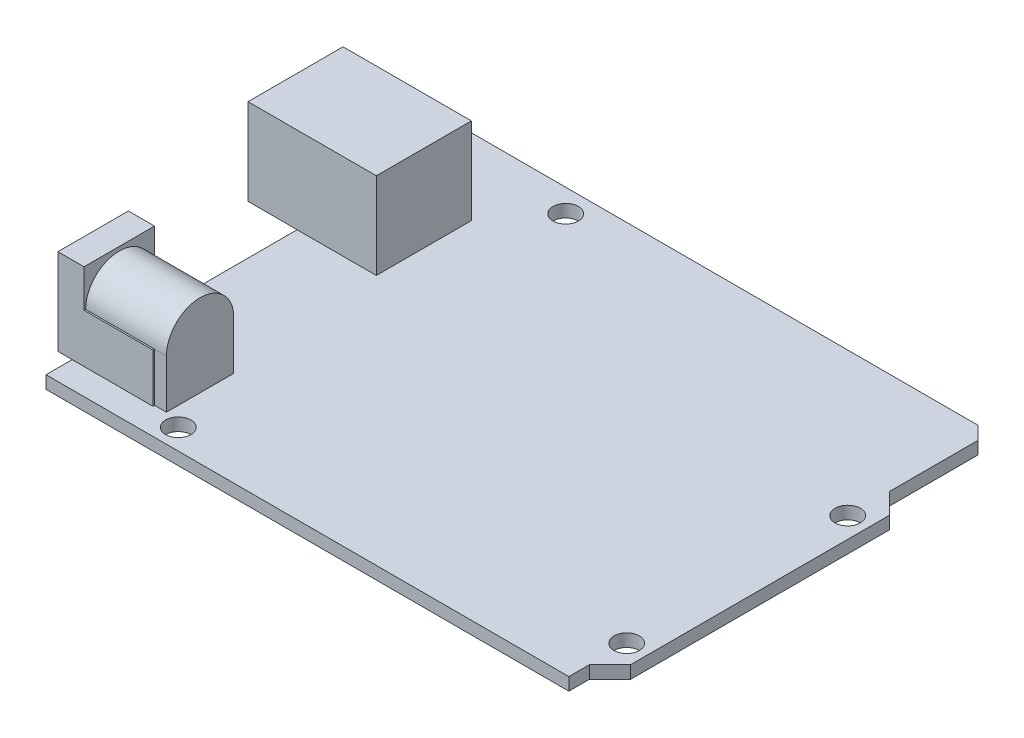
SolidWorks part; units mm, degrees
ref_plane "前基準面" through (0, 0, 0) normal (0, 0, 1) x (1, 0, 0)
ref_plane "上基準面" through (0, 0, 0) normal (0, 1, 0) x (1, 0, 0)
ref_plane "右基準面" through (0, 0, 0) normal (1, 0, 0) x (0, 0, -1)
sketch "草圖1" plane through (0, 0, 0) normal (0, 1, 0) x (1, 0, 0)
  line L0 (30.05, 26.65) -> (31.7, 25)
  line L1 (-34.3, 26.65) -> (30.05, 26.65)
  line L2 (-34.3, 26.65) -> (-34.3, -26.65)
  line L3 (-34.3, -26.65) -> (31.7, -26.65)
  line L4 (34.3, 11.25) -> (34.3, -21.45)
  line L5 (-34.3, 26.65) -> (34.3, -26.65) construction
  line L6 (-34.3, -26.65) -> (34.3, 26.65) construction
  line L7 (31.7, 25) -> (31.7, 13.85)
  line L8 (31.7, 13.85) -> (34.3, 11.25)
  line L9 (34.3, -21.45) -> (31.7, -24.05)
  line L10 (31.7, -24.05) -> (31.7, -26.65)
  line L11 (31.7, -26.65) -> (34.3, -26.65) construction
  line L12 (34.3, -26.65) -> (34.3, -21.45) construction
  line L13 (30.05, 26.65) -> (34.3, 26.65) construction
  line L14 (34.3, 26.65) -> (34.3, 11.25) construction
  line L15 (31.7, 13.85) -> (31.7, -24.05) construction
  circle A0 centre (-19.1, 23.75) radius 1.6
  circle A1 centre (-20.2, -24.05) radius 1.6
  circle A2 centre (31.7, 8.55) radius 1.6
  circle A3 centre (31.7, -19.35) radius 1.6
  point P0 (0, 0)
  point P22 (-20.2, -25.65)
  point P23 (-19.1, 25.35)
  point P26 (34.3, -5.1)
  dimension "D5" = 3.2
  dimension "D1" = 53.3
  dimension "D2" = 68.6
  dimension "D3" = 1.1
  dimension "D4" = 50.8
  dimension "D6" = 15.2
  dimension "D7" = 4.7
  dimension "D8" = 27.9
  dimension "D9" = 1.25
  dimension "D12" = 34.3
  dimension "D13" = 2.6
  dimension "D14" = 1
  dimension "D15" = 45
  dimension "D16" = 12.8
  dimension "D17" = 45
extrude "填料-伸長1" add sketch "草圖1" along normal blind 1.6
sketch "草圖3" plane through (0, 1.6, 0) normal (0, 1, 0) x (1, 0, 0)
  line L0 (30.05, 26.65) -> (-34.3, 26.65) construction
  line L1 (-40.5, 17.05) -> (-24.3, 17.05)
  line L2 (-40.5, 17.05) -> (-40.5, 5.05)
  line L3 (-40.5, 5.05) -> (-24.3, 5.05)
  line L4 (-24.3, 17.05) -> (-24.3, 5.05)
  line L5 (34.3, -21.45) -> (34.3, 11.25) construction
  dimension "D1" = 12
  dimension "D2" = 9.6
  dimension "D3" = 74.8
  dimension "D4" = 16.2
extrude "填料-伸長2" add sketch "草圖3" along normal blind 10.9
sketch "草圖4" plane through (0, 1.6, 0) normal (0, 1, 0) x (1, 0, 0)
  line L0 (-34.3, -26.65) -> (31.7, -26.65) construction
  line L1 (-36.1, -14.45) -> (-22.6, -14.45)
  line L2 (-36.1, -14.45) -> (-36.1, -23.35)
  line L3 (-36.1, -23.35) -> (-22.6, -23.35)
  line L4 (-22.6, -14.45) -> (-22.6, -23.35)
  dimension "D1" = 1.8
  dimension "D2" = 13.5
  dimension "D3" = 3.3
  dimension "D4" = 8.9
extrude "填料-伸長3" add sketch "草圖4" along normal blind 10.9
sketch "草圖5" plane through (-22.6, 0, 0) normal (1, 0, 0) x (0, 0, -1)
  line L0 (-18.9, 1.6) -> (-18.9, 12.5) construction
  line L1 (-23.35, 1.6) -> (-14.45, 1.6) construction
  line L2 (-23.35, 12.5) -> (-14.45, 12.5) construction
  line L3 (-23.35, 7.75) -> (-14.45, 7.75) construction
  line L4 (-23.35, 12.5) -> (-23.35, 1.6) construction
  line L5 (-14.45, 12.5) -> (-14.45, 1.6) construction
  line L6 (-23.15, 7.75) -> (-23.35, 7.75)
  line L7 (-23.35, 7.75) -> (-23.35, 1.6)
  line L8 (-14.65, 7.75) -> (-14.45, 7.75)
  line L9 (-14.45, 7.75) -> (-14.45, 1.6)
  line L10 (-14.45, 1.6) -> (-23.35, 1.6)
  line L11 (-23.15, 7.75) -> (-23.15, 1.6)
  line L12 (-14.65, 7.75) -> (-14.65, 1.6)
  arc A0 (-14.65, 7.75) -> (-23.15, 7.75) centre (-18.9, 7.75) ccw
  point P14 (-23.15, 7.75)
  point P16 (-23.35, 7.75)
  dimension "D1" = 4.75
  dimension "D2" = 0.2
extrude "除料-伸長1" cut sketch "草圖5" against normal blind 1.5 contours L11 L6 M5 M2 | L8 L12 M2 M3
sketch "草圖6" plane through (-22.6, 0, 0) normal (1, 0, 0) x (0, 0, -1)
  line L5 (-24.118, 7.75) -> (-23.15, 7.75)
  line L6 (-14.65, 7.75) -> (-13.8921, 7.75)
  line L10 (-24.118, 13.0396) -> (-24.118, 7.75)
  line L13 (-13.8921, 7.75) -> (-13.8921, 13.0396)
  line L14 (-13.8921, 13.0396) -> (-24.118, 13.0396)
  arc A1 (-14.65, 7.75) -> (-23.15, 7.75) centre (-18.9, 7.75) ccw
extrude "除料-伸長2" cut sketch "草圖6" against normal blind 10.2
sketch "草圖7" plane through (-36.1, 0, 0) normal (-1, 0, 0) x (0, 0, 1)
  line L0 (14.45, 12.5) -> (23.35, 12.5) construction
  line L1 (23.35, 12.5) -> (23.35, 1.6) construction
  circle A1 centre (18.9, 7.75) radius 3.1
  dimension "D1" = 6.2
  dimension "D2" = 4.75
  dimension "D3" = 4.45
extrude "除料-伸長3" cut sketch "草圖7" against normal blind 10.2
